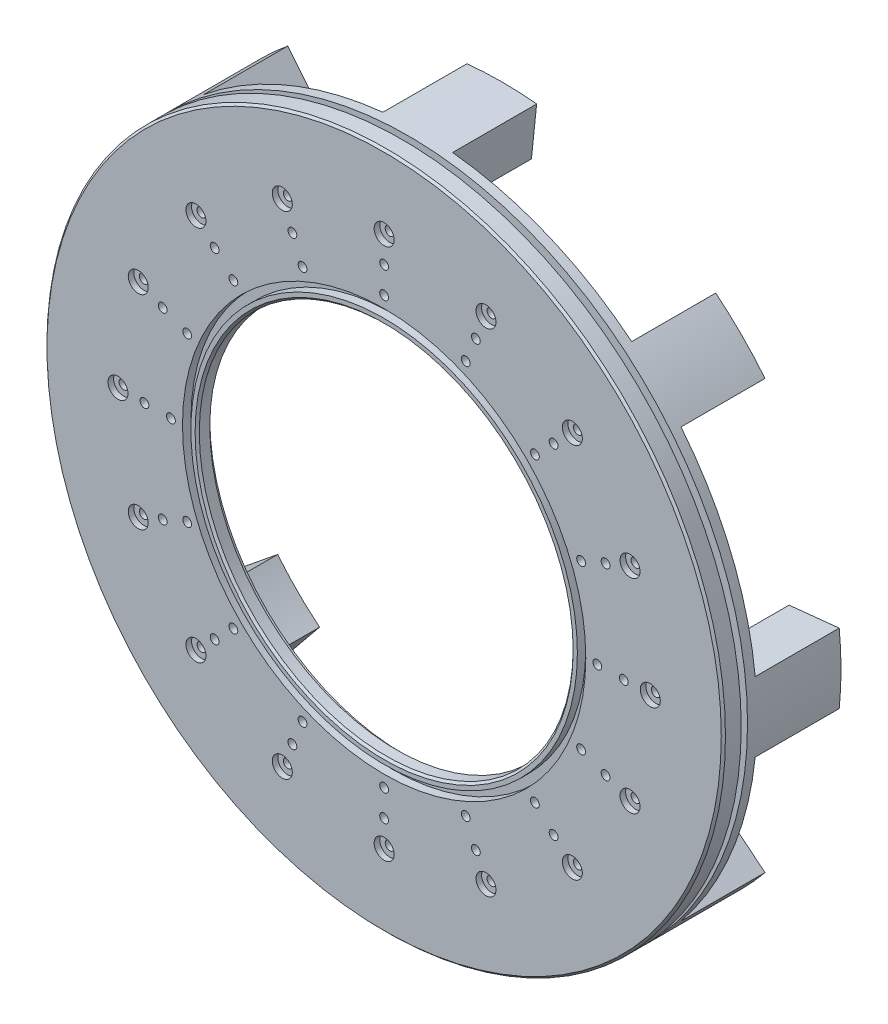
SolidWorks part; units mm, degrees
other "DetailItem1"
other "DetailItem2"
other "DetailItem3"
other "DetailItem4"
ref_plane "Front Plane" through (0, 0, 0) normal (0, 0, 1) x (1, 0, 0)
ref_plane "Top Plane" through (0, 0, 0) normal (0, 1, 0) x (1, 0, 0)
ref_plane "Right Plane" through (0, 0, 0) normal (1, 0, 0) x (0, 0, -1)
sketch "Sketch1" plane through (0, 0, 0) normal (0, 0, 1) x (1, 0, 0)
  circle A0 centre (0, 0) radius 137.5
  circle A1 centre (0, 0) radius 161.5
  dimension "D1" = 275
  dimension "D2" = 24
extrude "Boss-Extrude1" add sketch "Sketch1" along normal blind 50
sketch "Sketch2" plane through (0, 0, 50) normal (0, 0, 1) x (1, 0, 0)
  circle A0 centre (0, 0) radius 161.5
  circle A1 centre (0, 0) radius 89
  dimension "D1" = 323
  dimension "D2" = 178
extrude "Boss-Extrude2" add sketch "Sketch2" along normal blind 6
sketch "Sketch3" plane through (0, 0, 0) normal (0, 0, -1) x (-1, 0, 0)
  line L0 (0, 174.2976) -> (0, -182.6873) construction
  line L1 (-177.6535, 0) -> (190.2381, 0) construction
  line L2 (-111.7937, 148) -> (124.8217, 148) construction
  line L3 (-61.3548, 161.5) -> (76.7518, 161.5) construction
  circle A0 centre (0, 0) radius 161.5 construction
  circle A1 centre (0, 148) radius 6.35
  dimension "D2" = 12.7
  dimension "D1" = 13.5
extrude "Cut-Extrude1" cut sketch "Sketch3" against normal blind 30
sketch "Sketch4" plane through (0, 0, 50) normal (0, 0, -1) x (-1, 0, 0)
  circle A0 centre (0, 0) radius 96
  circle A1 centre (0, 0) radius 92
  circle A2 centre (0, 0) radius 119 construction
  circle A3 centre (0, 0) radius 123 construction
  dimension "D1" = 246
  dimension "D2" = 238
  dimension "D3" = 192
  dimension "D4" = 184
extrude "Boss-Extrude3" add sketch "Sketch4" along normal blind 3
sketch "Sketch5" plane through (0, 0, 50) normal (0, 0, -1) x (-1, 0, 0)
  circle A0 centre (0, 0) radius 119
  circle A1 centre (0, 0) radius 123
  dimension "D1" = 238
  dimension "D2" = 246
extrude "Boss-Extrude4" add sketch "Sketch5" along normal blind 3
sketch "Sketch6" plane through (0, 0, 50) normal (0, 0, -1) x (-1, 0, 0)
  line L0 (0, 189.4651) -> (0, -188.4615) construction
  circle A0 centre (0, 0) radius 101.5
  circle A1 centre (0, 0) radius 114.1
  circle A2 centre (0, 0) radius 126.7
  circle A3 centre (0, 126.7) radius 2.5
  circle A4 centre (0, 114.1) radius 2.5
  circle A5 centre (0, 101.5) radius 2.5
  dimension "D1" = 253.4
  dimension "D2" = 228.2
  dimension "D3" = 203
  dimension "D4" = 5
sketch "Sketch10" plane through (0, 0, 56) normal (0, 0, 1) x (1, 0, 0)
  line L0 (0, 184.818) -> (0, -178.0318) construction
  circle A0 centre (0, 0) radius 101.5
  circle A1 centre (0, 0) radius 114.1
  circle A2 centre (0, 114.1) radius 2.5
  circle A3 centre (0, 101.5) radius 2.5
  circle A4 centre (0, 0) radius 126.7
  circle A5 centre (0, 126.7) radius 2.5
  dimension "D1" = 228.2
  dimension "D2" = 203
  dimension "D3" = 5
  dimension "D4" = 253.4
  dimension "D5" = 5
hole_wizard "M5x0.8 Tapped Hole2" positions "3DSketch4" profile "Sketch11" tap size "M5x0.8" standard "Ansi Metric"
sketch3d "3DSketch4"
  point P0 (0, 114.1, 56)
  point P3 (0, 101.5, 56)
sketch "Sketch11" plane through (0, 114.1, 56) normal (1, 0, 0) x (0, -1, 0)
  line L0 (0, 0) -> (0, 8.2618)
  line L1 (0, 8.2618) -> (2.1, 7)
  line L2 (2.1, 7) -> (2.1, 0)
  line L5 (2.1, 0) -> (0, 0)
  line L10 (0, 8.2618) -> (-2.1, 7) construction
  line L11 (0, -6.35) -> (0, 107.95) construction
  dimension "Tap Drill Dia." = 4.2
  dimension "Tap Drill Depth" = 7
  dimension "Drill Angle" = 118
hole_wizard "CBORE for #8 Binding Head Machine Screw2" positions "3DSketch6" profile "Sketch13" counterbore size "#8" standard "Ansi Inch"
sketch3d "3DSketch6"
  point P0 (0, 126.7, 56)
sketch "Sketch13" plane through (0, 126.7, 56) normal (1, 0, 0) x (0, -1, 0)
  line L0 (0, 0) -> (0, 56)
  line L1 (0, 56) -> (2.1526, 56)
  line L3 (2.1526, 56) -> (2.1527, 2.667)
  line L4 (2.1527, 2.667) -> (4.7625, 2.667)
  line L5 (4.7625, 2.667) -> (4.7625, 0)
  line L7 (4.7625, 0) -> (0, 0)
  line L11 (0, -6.35) -> (0, 107.95) construction
  dimension "Thru Hole Dia." = 4.3053
  dimension "Thru Hole Depth" = 56
  dimension "C'Bore Dia." = 9.525
  dimension "C'Bore Depth" = 2.667
pattern_circular "CirPattern2" count 16 over 360 about axis through (0, 0, 0) along (0, 0, 1) of "M5x0.8 Tapped Hole2", "CBORE for #8 Binding Head Machine Screw2"
ref_plane "Plane1" through (0, 0, 46) normal (0, 0, 1) x (1, 0, 0)
sketch "Sketch14" plane through (0, 0, 46) normal (0, 0, 1) x (1, 0, 0)
  circle A0 centre (0, 0) radius 147.5
  circle A1 centre (0, 0) radius 165
  dimension "D1" = 295
  dimension "D2" = 330
extrude "Cut-Extrude2" cut sketch "Sketch14" against normal mid plane 3
sketch "Sketch15" plane through (0, 0, 56) normal (0, 0, 1) x (1, 0, 0)
  circle A0 centre (0, 0) radius 92
  circle A1 centre (0, 0) radius 96
  dimension "D1" = 192
  dimension "D2" = 184
extrude "Cut-Extrude3" cut sketch "Sketch15" against normal blind 4
sketch "Sketch16" plane through (0, 0, 0) normal (0, 0, -1) x (-1, 0, 0)
  line L0 (0, -172.3544) -> (0, 182.6504) construction
  line L1 (0, 0) -> (17.984, -174.0735) construction
  line L2 (17.984, -174.0735) -> (110.3719, -135.8051)
  line L3 (110.3719, -135.8051) -> (0, 0) construction
  line L4 (0, 0) -> (77.3034, -186.6269) construction
  line L5 (84.0467, -103.4137) -> (13.6946, -132.5545)
  line L6 (17.984, -174.0735) -> (13.6946, -132.5545)
  line L7 (110.3719, -135.8051) -> (84.0467, -103.4137)
  dimension "D1" = 22.5
  dimension "D2" = 175
  dimension "D3" = 100
  dimension "D4" = 40
extrude "Cut-Extrude4" cut sketch "Sketch16" against normal blind 40
pattern_circular "CirPattern7" count 8 over 360 about axis through (0, 0, 0) along (0, 0, 1) of "Cut-Extrude4"
ref_plane "Plane2" through (0, 0, 6.016) normal (0, 0, -1) x (-1, 0, 0)
sketch "Sketch19" plane through (0, 0, 6.016) normal (0, 0, -1) x (-1, 0, 0)
  circle A1 centre (0, 148) radius 6.731
  dimension "D2" = 13.462
extrude "Cut-Extrude6" cut sketch "Sketch19" against normal blind 1.016
pattern_circular "CirPattern8" count 8 over 360 about axis through (0, 0, 0) along (0, 0, 1) of "Cut-Extrude1", "Cut-Extrude6"
fillet "Fillet1" radius 1 1 edges at (137.5, 0, 50)
chamfer "Chamfer1" distance 1 angle 45 2 edges at (161.5, 0, 56) (89, 0, 56)
